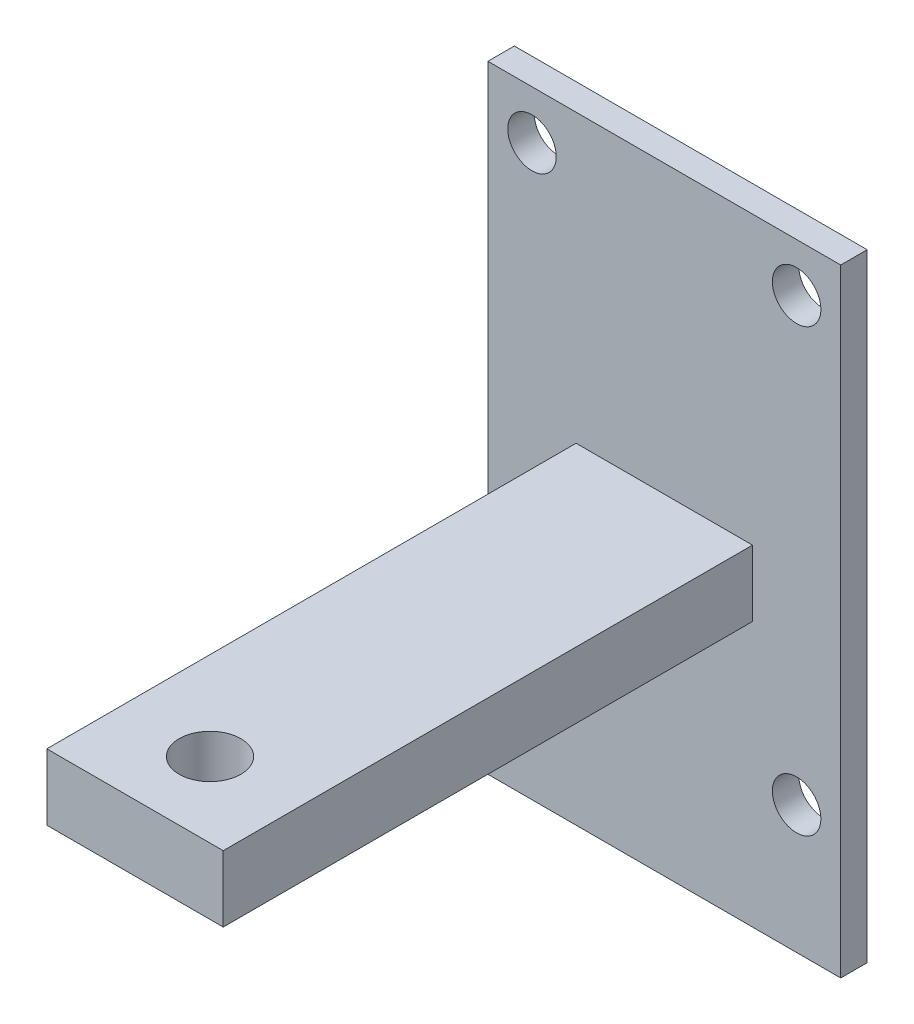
SolidWorks part; units mm, degrees
ref_plane "Plan1" through (0, 0, 0) normal (0, 0, 1) x (1, 0, 0)
ref_plane "Plan2" through (0, 0, 0) normal (0, 1, 0) x (1, 0, 0)
ref_plane "Plan3" through (0, 0, 0) normal (1, 0, 0) x (0, 0, -1)
sketch "Esquisse1" plane through (0, 0, 0) normal (0, 0, 1) x (1, 0, 0)
  line L1 (0, 0) -> (80, 0)
  line L2 (0, 0) -> (0, 140)
  line L3 (0, 140) -> (80, 140)
  line L4 (80, 0) -> (80, 140)
  dimension "D1" = 80
  dimension "D2" = 140
extrude "Base-Extrusion" add sketch "Esquisse1" along normal blind 6
sketch "Esquisse2" plane through (0, 0, 6) normal (0, 0, 1) x (1, 0, 0)
  line L0 (80, 140) -> (0, 140) construction
  line L1 (20, 75) -> (60, 75)
  line L2 (20, 75) -> (20, 60)
  line L3 (20, 60) -> (60, 60)
  line L4 (60, 75) -> (60, 60)
  line L5 (0, 140) -> (0, 0) construction
  dimension "D1" = 40
  dimension "D2" = 15
  dimension "D3" = 65
  dimension "D4" = 20
extrude "Boss.-Extru.1" add sketch "Esquisse2" along normal blind 120
sketch "Esquisse3" plane through (0, 75, 0) normal (0, 1, 0) x (-1, 0, 0)
  line L0 (-60, 126) -> (-60, 6) construction
  line L1 (-80, 6) -> (0, 6) construction
  circle A0 centre (-40, 109) radius 7
  dimension "D1" = 14
  dimension "D2" = 20
  dimension "D3" = 103
extrude "Enlèv. mat.-Extru.1" cut sketch "Esquisse3" against normal through all
sketch "Esquisse4" plane through (0, 0, 6) normal (0, 0, 1) x (1, 0, 0)
  line L0 (0, 140) -> (0, 0) construction
  circle A0 centre (10, 129) radius 5.5
  circle A1 centre (70, 129) radius 5.5
  circle A2 centre (70, 29) radius 5.5
  circle A3 centre (10, 29) radius 5.5
  dimension "D7" = 11
  dimension "D8" = 11
  dimension "D9" = 11
  dimension "D10" = 11
  dimension "D1" = 10
  dimension "D2" = 60
  dimension "D3" = 100
  dimension "D4" = 100
  dimension "D5" = 60
  dimension "D6" = 10
extrude "Enlèv. mat.-Extru.2" cut sketch "Esquisse4" against normal through all
